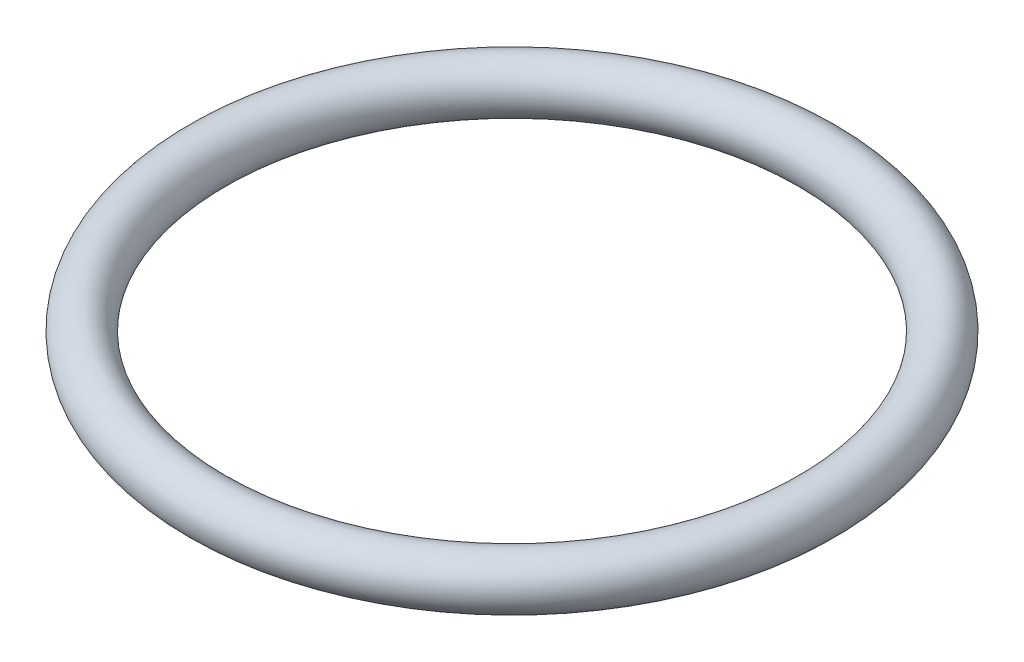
SolidWorks part; units mm, degrees
ref_plane "Piano frontale" through (0, 0, 0) normal (0, 0, 1) x (1, 0, 0)
ref_plane "Piano superiore" through (0, 0, 0) normal (0, 1, 0) x (1, 0, 0)
ref_plane "Piano destro" through (0, 0, 0) normal (1, 0, 0) x (0, 0, -1)
sketch "Schizzo1" plane through (0, 0, 0) normal (0, 0, 1) x (1, 0, 0)
  line L0 (0, 0) -> (0, 70.7604) construction
  line L1 (-14.45, 3.1451) -> (-14.45, -3.2579) construction
  circle A0 centre (-15.76, 0) radius 1.31
  dimension "D1" = 2.62
  dimension "D2" = 14.45
revolve "Rivoluzione1" add sketch "Schizzo1" angle 360 about L0
